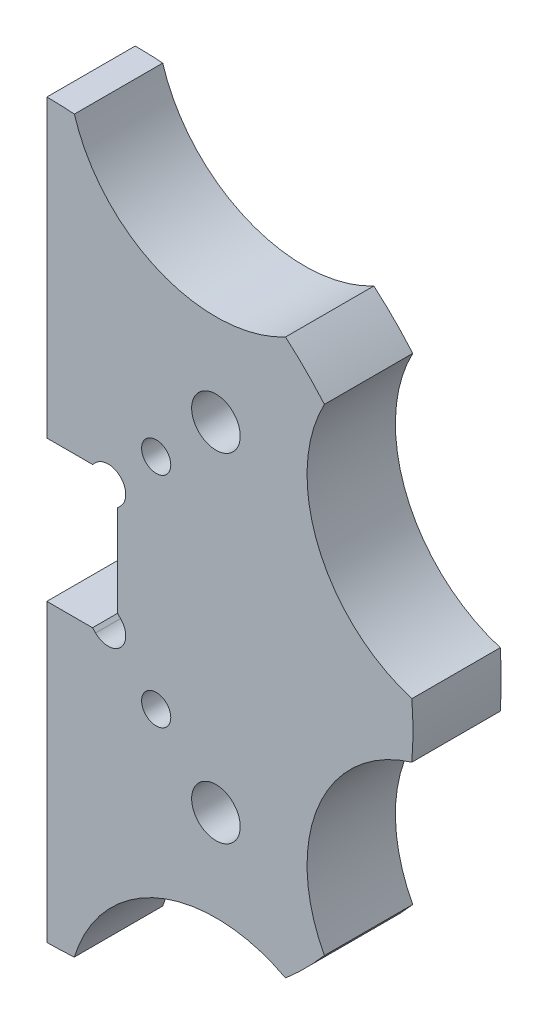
SolidWorks part; units mm, degrees
ref_plane "Plan de face" through (0, 0, 0) normal (0, 0, 1) x (1, 0, 0)
ref_plane "Plan de dessus" through (0, 0, 0) normal (0, 1, 0) x (1, 0, 0)
ref_plane "Plan de droite" through (0, 0, 0) normal (1, 0, 0) x (0, 0, -1)
sketch "Esquisse1" plane through (0, 0, 0) normal (0, 0, 1) x (1, 0, 0)
  line L0 (-60.6442, 0) -> (58.9534, 0) construction
  line L1 (0, 71.2062) -> (0, -63.7613) construction
  line L2 (0, 0) -> (19.1342, 46.194) construction
  line L3 (0, 41.4241) -> (0, 8)
  line L4 (0, 8) -> (8, 8)
  line L5 (0, -8) -> (0, -41.4241)
  line L6 (0, -8) -> (8, -8)
  line L7 (8, 8) -> (8, -8)
  circle A0 centre (19.1342, 46.194) radius 16.75 construction
  circle A1 centre (46.194, 19.1342) radius 16.75 construction
  circle A2 centre (46.194, -19.1342) radius 16.75 construction
  circle A3 centre (19.1342, -46.194) radius 16.75 construction
  circle A6 centre (19.1342, 19.1342) radius 2.75
  circle A7 centre (19.1342, -19.1342) radius 2.75
  arc A10 (3.1129, 41.307) -> (27.0073, 31.4096) centre (19.1342, 46.194) ccw
  arc A11 (31.4096, 27.0073) -> (41.307, 3.1129) centre (46.194, 19.1342) ccw
  arc A12 (41.307, -3.1129) -> (31.4096, -27.0073) centre (46.194, -19.1342) ccw
  arc A13 (27.0073, -31.4096) -> (3.1129, -41.307) centre (19.1342, -46.194) ccw
  arc A19 (0, -41.4241) -> (3.1129, -41.307) centre (0, 0) ccw
  arc A20 (27.0073, -31.4096) -> (31.4096, -27.0073) centre (0, 0) ccw
  arc A21 (41.307, -3.1129) -> (41.307, 3.1129) centre (0, 0) ccw
  arc A22 (31.4096, 27.0073) -> (27.0073, 31.4096) centre (0, 0) ccw
  arc A23 (3.1129, 41.307) -> (0, 41.4241) centre (0, 0) ccw
  arc A24 (-27.0073, 31.4096) -> (-3.1129, 41.307) centre (-19.1342, 46.194) ccw
  arc A25 (-3.1129, -41.307) -> (-27.0073, -31.4096) centre (-19.1342, -46.194) ccw
  arc A26 (-31.4096, -27.0073) -> (-41.307, -3.1129) centre (-46.194, -19.1342) ccw
  arc A27 (-41.307, 3.1129) -> (-31.4096, 27.0073) centre (-46.194, 19.1342) ccw
  circle A28 centre (-19.1342, 46.194) radius 16.75 construction
  circle A29 centre (-46.194, 19.1342) radius 16.75 construction
  circle A30 centre (-46.194, -19.1342) radius 16.75 construction
  circle A31 centre (-19.1342, -46.194) radius 16.75 construction
  dimension "D1" = 33.5
  dimension "D6" = 8
  dimension "D9" = 5.5
  dimension "D2" = 22.5
  dimension "D3" = 50
  dimension "D8" = 16
  dimension "D4" = 8
  dimension "D5" = 8
extrude "Boss.-Extru.1" add sketch "Esquisse1" along normal blind 10
hole_wizard "Trou taraudé M41" positions "Esquisse4" profile "Esquisse3" tap size "M4" standard "ISO"
sketch "Esquisse4" plane through (0, 0, 10) normal (0, 0, 1) x (1, 0, 0)
  point P1 (12.3744, 12.3744)
  point P8 (12.3744, -12.3744)
sketch "Esquisse3" plane through (12.3744, 12.3744, 10) normal (1, 0, 0) x (0, -1, 0)
  line L0 (0, 0) -> (0, 10)
  line L1 (0, 10) -> (1.65, 10)
  line L2 (1.65, 10) -> (1.65, 0)
  line L5 (1.65, 0) -> (0, 0)
  line L11 (0, -6.35) -> (0, 107.95) construction
  dimension "Diamètre du trou pour taraudage jusqu'au prochain" = 3.3
  dimension "Profondeur du trou pour taraudage jusqu'au prochain" = 10
sketch "Esquisse5" plane through (0, 0, 10) normal (0, 0, 1) x (1, 0, 0)
  line L0 (0, 0) -> (6.9296, 6.9296) construction
  line L1 (8.3439, 5.5154) -> (4.6152, 9.2441) construction
  line L2 (5.5154, 8.3439) -> (5.1716, 8)
  line L3 (0, 8) -> (8, 8) construction
  line L4 (8.3439, 5.5154) -> (8, 5.1716)
  line L5 (8, 8) -> (8, -8) construction
  line L6 (8, 5.1716) -> (5.1716, 8)
  line L7 (-4.29, 0) -> (16.4144, 0) construction
  line L8 (8.3439, -5.5154) -> (4.6152, -9.2441) construction
  line L9 (0, 0) -> (6.9296, -6.9296) construction
  line L10 (8, -5.1716) -> (5.1716, -8)
  line L11 (8.3439, -5.5154) -> (8, -5.1716)
  line L12 (5.5154, -8.3439) -> (5.1716, -8)
  arc A0 (8.3439, 5.5154) -> (5.5154, 8.3439) centre (6.9296, 6.9296) ccw
  arc A1 (8.3439, -5.5154) -> (5.5154, -8.3439) centre (6.9296, -6.9296) cw
  dimension "D1" = 4
  dimension "D2" = 9.8
extrude "Enlèv. mat.-Extru.1" cut sketch "Esquisse5" against normal through all
